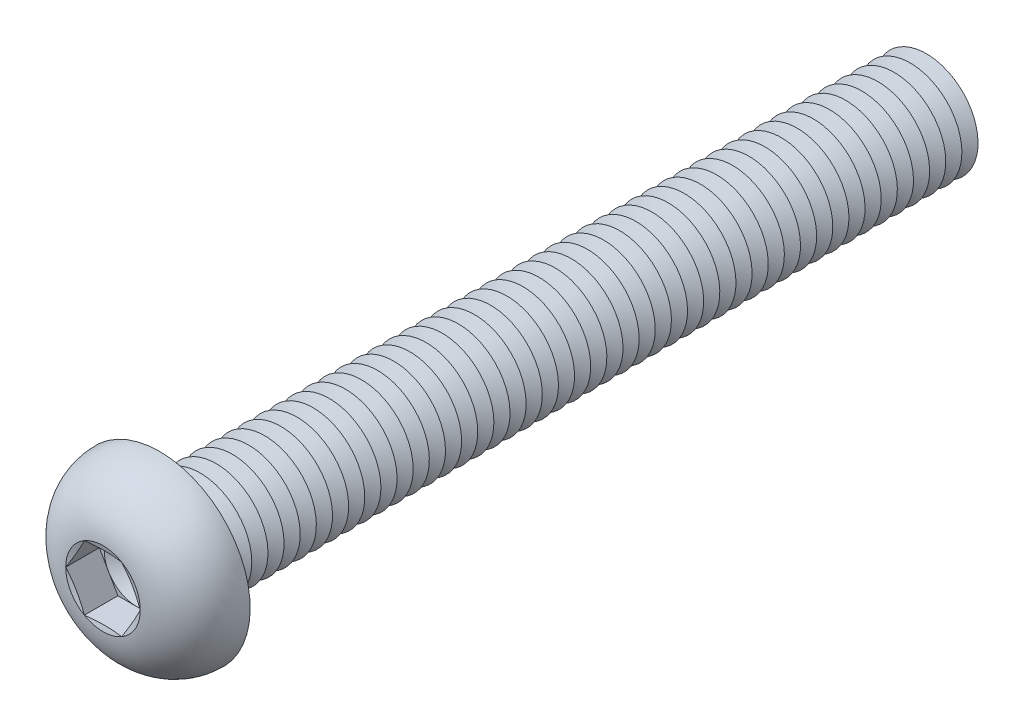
SolidWorks part; units mm, degrees
ref_plane "Front Plane" through (0, 0, 0) normal (0, 0, 1) x (1, 0, 0)
ref_plane "Top Plane" through (0, 0, 0) normal (0, 1, 0) x (1, 0, 0)
ref_plane "Right Plane" through (0, 0, 0) normal (1, 0, 0) x (0, 0, -1)
sketch "Sketch1" plane through (0, 0, 0) normal (1, 0, 0) x (0, 0, -1)
  line L0 (0, 4) -> (0, 7)
  line L3 (0, 4) -> (60, 4)
  line L4 (60, 4) -> (60, 0)
  line L5 (60, 0) -> (-4.4, 0) construction
  line L6 (-4.4, 0) -> (60, 0)
  line L7 (-4.4, 2.8867) -> (-4.4, 1.4434) construction
  line L8 (-4.4, 1.4434) -> (-4.4, 0)
  line L9 (-4.4, 2.8867) -> (-4.0132, 1.4434)
  line L10 (-4.0132, 1.4434) -> (-4.4, 1.4434)
  line L11 (60, 0) -> (22.7481, 0) construction
  line L12 (0, 7) -> (-4.4, 7) construction
  arc A1 (0, 7) -> (-4.4, 2.8867) centre (0, 2.59) ccw
  point P8 (60, 2)
  dimension "D1" = 14
  dimension "D2" = 8
  dimension "D3" = 4.4
  dimension "D4" = 5.7735
  dimension "D5" = 60
  dimension "D6" = 15
revolve "Revolve1" add sketch "Sketch1" angle 360 about L5
fillet "Fillet1" radius 0.625 1 edges at (0, 4, 0)
sketch "Sketch2" plane through (0, 0, 0) normal (1, 0, 0) x (0, 0, -1)
  line L0 (59.375, 4) -> (60.625, 4)
  line L1 (60, 4) -> (0.625, 4) construction
  line L2 (60.625, 4) -> (60, 2.9175)
  line L3 (60, -4) -> (60, 4) construction
  line L4 (60, 2.9175) -> (59.375, 4)
  dimension "D1" = 1.25
revolve "Cut-Revolve1" cut sketch "Sketch2" angle 360 about axis through (0, 0, -60) along (0, 0, -1)
pattern_linear "LPattern1" count 48 spacing 1.25 along (0, 0, 1) of "Cut-Revolve1"
sketch "Sketch3" plane through (0, 0, 4.4) normal (0, 0, 1) x (1, 0, 0)
  line L7 (1.4434, 2.5) -> (-1.4434, 2.5)
  line L8 (-1.4434, 2.5) -> (-2.8867, 0)
  line L9 (-2.8867, 0) -> (-1.4434, -2.5)
  line L10 (-1.4434, -2.5) -> (1.4434, -2.5)
  line L11 (1.4434, -2.5) -> (2.8867, 0)
  line L12 (2.8867, 0) -> (1.4434, 2.5)
  circle A0 centre (0, 0) radius 2.5 construction
  circle A3 centre (0, 0) radius 2.8867 construction
extrude "Cut-Extrude1" cut sketch "Sketch3" against normal blind 2.6
sketch "Sketch4" plane through (0, 0, 1.8) normal (0, 0, 1) x (1, 0, 0)
  line L1 (1.4434, 2.5) -> (-1.4434, 2.5) construction
  circle A0 centre (0, 0) radius 2.5
extrude "Cut-Extrude2" cut sketch "Sketch4" against normal through all draft 60
